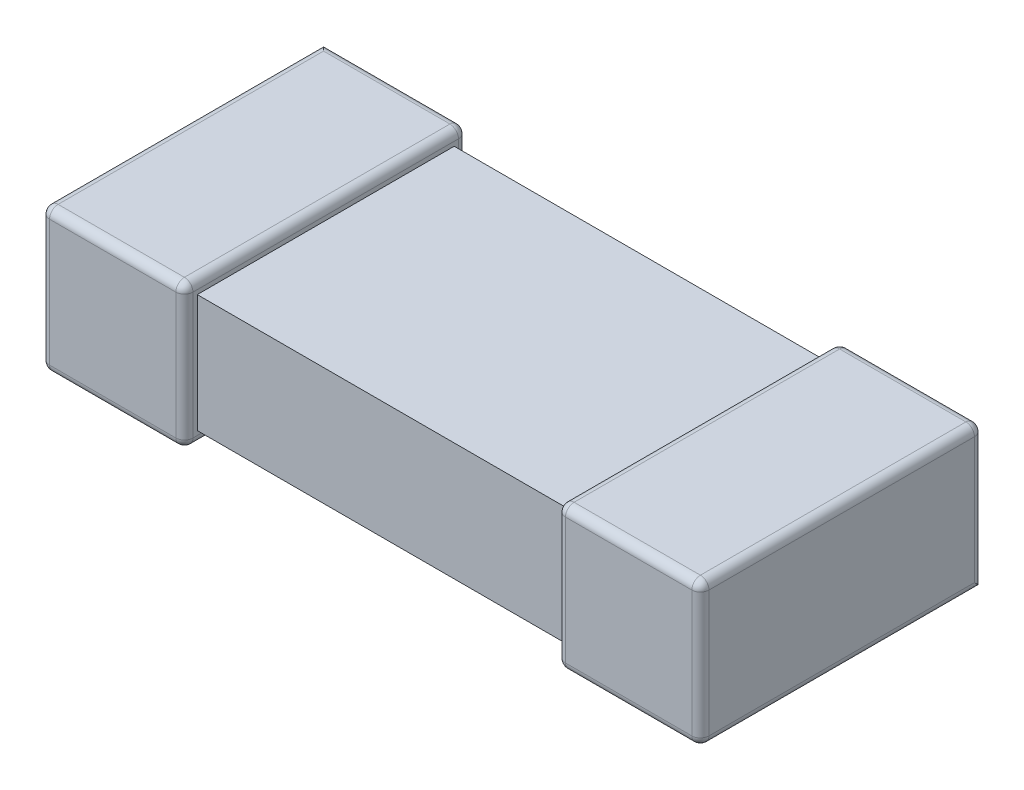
SolidWorks part; units mm, degrees
ref_plane "Front Plane" through (0, 0, 0) normal (0, 0, 1) x (1, 0, 0)
ref_plane "Top Plane" through (0, 0, 0) normal (0, 1, 0) x (1, 0, 0)
ref_plane "Right Plane" through (0, 0, 0) normal (1, 0, 0) x (0, 0, -1)
sketch "Sketch1" plane through (0, 0, 0) normal (0, 1, 0) x (1, 0, 0)
  line L1 (-1.1049, 0.762) -> (1.1049, 0.762)
  line L2 (-1.1049, 0.762) -> (-1.1049, -0.762)
  line L3 (-1.1049, -0.762) -> (1.1049, -0.762)
  line L4 (1.1049, 0.762) -> (1.1049, -0.762)
  line L5 (-1.1049, 0.762) -> (1.1049, -0.762) construction
  line L6 (-1.1049, -0.762) -> (1.1049, 0.762) construction
  point P0 (0, 0)
extrude "Boss-Extrude1" add sketch "Sketch1" along normal blind 0.6985
sketch "Sketch3" plane through (-1.1049, 0, 0) normal (-1, 0, 0) x (0, 0, 1)
  line L4 (-0.8382, -0.0762) -> (0.8382, -0.0762)
  line L5 (-0.8382, -0.0762) -> (-0.8382, 0.7747)
  line L6 (-0.8382, 0.7747) -> (0.8382, 0.7747)
  line L7 (0.8382, -0.0762) -> (0.8382, 0.7747)
  line L8 (-0.8382, -0.0762) -> (0.8382, 0.7747) construction
  line L9 (-0.8382, 0.7747) -> (0.8382, -0.0762) construction
  point P6 (0, 0.3493)
extrude "Boss-Extrude2" add sketch "Sketch3" along normal blind 0.8509
sketch "Sketch4" plane through (1.1049, 0, 0) normal (1, 0, 0) x (0, 0, -1)
  line L4 (-0.8382, -0.0762) -> (0.8382, -0.0762)
  line L5 (-0.8382, -0.0762) -> (-0.8382, 0.7747)
  line L6 (-0.8382, 0.7747) -> (0.8382, 0.7747)
  line L7 (0.8382, -0.0762) -> (0.8382, 0.7747)
  line L8 (-0.8382, -0.0762) -> (0.8382, 0.7747) construction
  line L9 (-0.8382, 0.7747) -> (0.8382, -0.0762) construction
  point P6 (0, 0.3493)
extrude "Boss-Extrude3" add sketch "Sketch4" along normal blind 0.8509
fillet "Fillet1" radius 0.0508 11 edges at (-1.1049, 0.3492, -0.8382) (-1.1049, -0.0762, 0) (-1.1049, 0.3492, 0.8382) (-1.1049, 0.7747, 0) (-1.9558, -0.0762, 0) (-1.5304, -0.0762, -0.8382) (-1.5304, 0.7747, -0.8382) (-1.9558, 0.7747, 0) (-1.9558, 0.3492, 0.8382) (-1.5304, -0.0762, 0.8382) (-1.5304, 0.7747, 0.8382)
fillet "Fillet2" radius 0.0508 11 edges at (1.9558, 0.3493, -0.8382) (1.1049, 0.3493, -0.8382) (1.5303, 0.7747, -0.8382) (1.9558, 0.7747, 0) (1.5303, 0.7747, 0.8382) (1.9558, 0.3493, 0.8382) (1.5303, -0.0762, 0.8382) (1.1049, -0.0762, 0) (1.1049, 0.3493, 0.8382) (1.1049, 0.7747, 0) (1.9558, -0.0762, 0)
